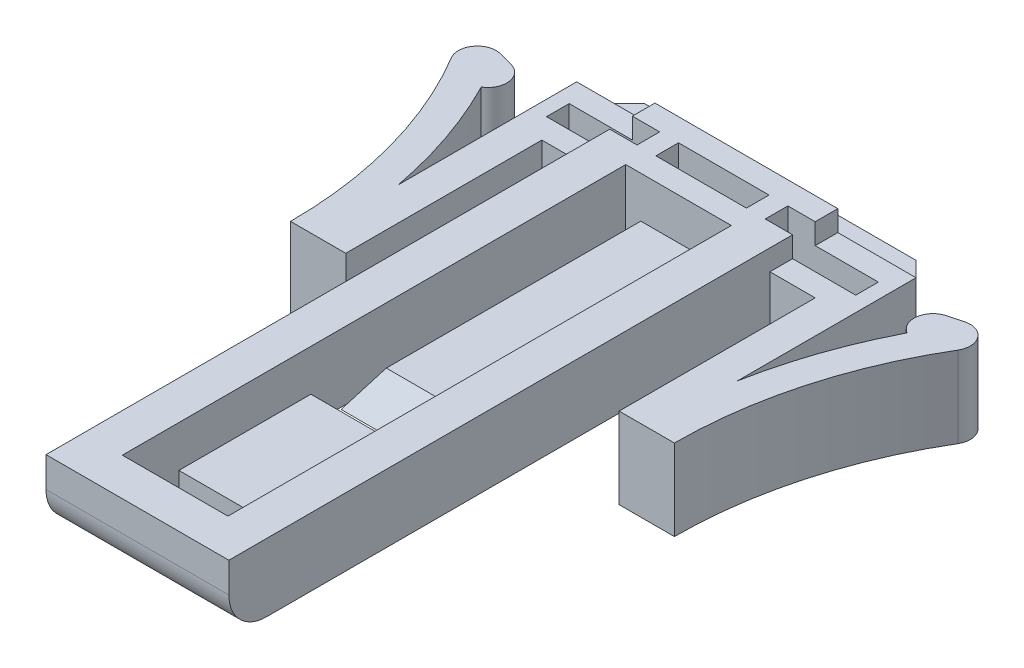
SolidWorks part; units mm, degrees
ref_plane "Спереди" through (0, 0, 0) normal (0, 0, 1) x (1, 0, 0)
ref_plane "Сверху" through (0, 0, 0) normal (0, 1, 0) x (1, 0, 0)
ref_plane "Справа" through (0, 0, 0) normal (1, 0, 0) x (0, 0, -1)
sketch "Эскиз1" plane through (0, 0, 0) normal (0, 1, 0) x (1, 0, 0)
  line L0 (0, 0) -> (0, 16.15) construction
  line L1 (4.85, 16.15) -> (-4.85, 16.15)
  line L2 (4.85, 16.15) -> (4.85, -16.15)
  line L3 (4.85, -16.15) -> (-4.85, -16.15)
  line L4 (-4.85, 16.15) -> (-4.85, -16.15)
  line L5 (4.85, 16.15) -> (-4.85, -16.15) construction
  line L6 (4.85, -16.15) -> (-4.85, 16.15) construction
  line L7 (-2.4, 14.95) -> (2.4, 14.95)
  line L8 (-2.4, 14.95) -> (-2.4, 13.75)
  line L9 (-2.4, 13.75) -> (2.4, 13.75)
  line L10 (2.4, 14.95) -> (2.4, 13.75)
  line L11 (4.85, 13.75) -> (3.4, 13.75)
  line L12 (4.85, 13.75) -> (4.85, 14.95)
  line L13 (4.85, 14.95) -> (3.4, 14.95)
  line L14 (3.4, 13.75) -> (3.4, 14.95)
  line L15 (-4.85, 13.75) -> (-3.4, 13.75)
  line L16 (-4.85, 13.75) -> (-4.85, 14.95)
  line L17 (-4.85, 14.95) -> (-3.4, 14.95)
  line L18 (-3.4, 13.75) -> (-3.4, 14.95)
  line L19 (-2, 12.55) -> (-2, -3.35)
  line L20 (-2.8, -14.15) -> (2.8, -14.15)
  line L21 (-2.8, -14.15) -> (-2.8, -11.15)
  line L22 (-2.8, -11.15) -> (2.8, -11.15)
  line L23 (2.8, -14.15) -> (2.8, -11.15)
  line L24 (2.8, -4.15) -> (-2.8, -4.15)
  line L25 (2.8, -4.15) -> (2.8, 12.55)
  line L26 (2.8, 12.55) -> (-2.8, 12.55)
  line L27 (-2.8, -4.15) -> (-2.8, 12.55)
  line L28 (-2, -3.35) -> (2, -3.35)
  line L29 (2, -3.35) -> (2, 12.55)
  point P0 (0, 0)
  dimension "D1" = 9.7
  dimension "D2" = 32.3
  dimension "D3" = 1.2
  dimension "D4" = 1.2
  dimension "D5" = 4.8
  dimension "D6" = 1
  dimension "D7" = 5.6
  dimension "D8" = 2
  dimension "D9" = 3
  dimension "D10" = 7
  dimension "D11" = 1.2
  dimension "D12" = 4
  dimension "D13" = 0.8
extrude "Бобышка-Вытянуть1" add sketch "Эскиз1" along normal blind 3.6 contours L18 L15 L4 L3 L2 L11 L14 L13 L1 L17 L23 L20 L21 L22 L7 L10 L9 L8 L24 L27 L26 L25 | L28 L29 L26 L19
fillet "Скругление1" radius 2 1 edges at (0, 0, 16.15)
sketch "Эскиз2" plane through (0, 0, 0) normal (0, -1, 0) x (1, 0, 0)
  line L0 (2, 3.35) -> (2, -12.55) construction
  line L1 (-2, 3.35) -> (2, 3.35)
  line L2 (-2, 3.35) -> (-2, -3.45)
  line L3 (-2, -3.45) -> (2, -3.45)
  line L4 (2, 3.35) -> (2, -3.45)
  dimension "D1" = 6.8
extrude "Бобышка-Вытянуть2" add sketch "Эскиз2" along normal blind 1.8
sketch "Эскиз3" plane through (0, 3.6, 0) normal (0, 1, 0) x (1, 0, 0)
  line L1 (2.8, -14.15) -> (-2.8, -14.15)
  line L2 (2.8, -14.15) -> (2.8, 12.55)
  line L3 (2.8, 12.55) -> (-2.8, 12.55)
  line L4 (-2.8, -14.15) -> (-2.8, 12.55)
extrude "Вырез-Вытянуть1" cut sketch "Эскиз3" against normal blind 2.2
sketch "Эскиз4" plane through (0, 0, 0) normal (1, 0, 0) x (0, 0, -1)
  line L0 (-3.35, 0.7) -> (-3.35, -1.8)
  line L1 (-3.35, 1.4) -> (-3.35, -1.8) construction
  line L2 (-3.35, -1.8) -> (0.65, -1.8)
  line L3 (-3.35, -1.8) -> (3.45, -1.8) construction
  line L4 (0.65, -1.8) -> (-3.35, 0.7)
  line L5 (-3.35, 1.4) -> (-0.95, 1.4)
  line L6 (12.55, 1.4) -> (-3.35, 1.4) construction
  line L7 (-0.95, 1.4) -> (-3.35, 0.7)
  line L8 (-3.35, 0.7) -> (-3.35, 1.4)
  line L9 (-4.15, 0.7) -> (-3.35, 0.7)
  line L10 (-4.15, 1.4) -> (-4.15, 0) construction
  line L11 (3.45, -1.8) -> (3.45, 0) construction
  point P14 (-3.35, 0.6668)
  point P18 (-3.35, 0.6714)
  dimension "D1" = 2.8
  dimension "D2" = 2.4
extrude "Вырез-Вытянуть2" cut sketch "Эскиз4" against normal mid plane 4.5 contours L2 L4 L0 | L8 L7 L5
ref_plane "Плоскость1" through (0, 2.5, 0) normal (0, 1, 0) x (1, 0, 0)
sketch "Эскиз5" plane through (0, 2.5, 0) normal (0, 1, 0) x (1, 0, 0)
  line L0 (-7.25, 12.55) -> (7.25, 12.55)
  line L1 (7.25, 12.55) -> (7.25, 2.15)
  line L2 (7.25, 2.15) -> (10.1812, 2.15)
  line L3 (-7.25, 12.55) -> (-7.25, 2.15)
  line L4 (-7.25, 2.15) -> (-10.1812, 2.15)
  line L5 (-9, 6.6697) -> (-9, 16.15)
  line L6 (-9, 16.15) -> (9, 16.15)
  line L7 (9, 16.15) -> (9, 6.6697)
  line L8 (0, 0) -> (0, 16.15) construction
  line L9 (4.85, 16.15) -> (-4.85, 16.15) construction
  line L10 (2.8, 12.55) -> (-2.8, 12.55) construction
  line L11 (4.85, 13.75) -> (3.4, 13.75) construction
  line L12 (-2.4, 14.95) -> (2.4, 14.95)
  line L13 (-2.4, 14.95) -> (-2.4, 13.75)
  line L14 (-2.4, 13.75) -> (2.4, 13.75)
  line L15 (2.4, 14.95) -> (2.4, 13.75)
  line L16 (3.4, 14.95) -> (8.2, 14.95)
  line L17 (3.4, 14.95) -> (3.4, 13.75)
  line L18 (3.4, 13.75) -> (8.2, 13.75)
  line L19 (8.2, 14.95) -> (8.2, 13.75)
  line L20 (-3.4, 14.95) -> (-8.2, 14.95)
  line L21 (-3.4, 14.95) -> (-3.4, 13.75)
  line L22 (-3.4, 13.75) -> (-8.2, 13.75)
  line L23 (-8.2, 14.95) -> (-8.2, 13.75)
  line L24 (-12.5727, 14.45) -> (-11.8, 14.2429) construction
  line L25 (-12.3139, 15.4159) -> (-11.5412, 15.2089)
  line L26 (-12.8316, 13.4841) -> (-12.0588, 13.277)
  line L27 (12.5727, 14.45) -> (11.8, 14.2429) construction
  line L28 (12.3139, 15.4159) -> (11.5412, 15.2089)
  line L29 (12.8316, 13.4841) -> (12.0588, 13.277)
  arc A0 (-12.3139, 15.4159) -> (-12.8316, 13.4841) centre (-12.5727, 14.45) ccw
  arc A1 (-12.0588, 13.277) -> (-11.5412, 15.2089) centre (-11.8, 14.2429) ccw
  arc A2 (-10.1812, 2.15) -> (-13.4314, 13.9375) centre (-33.1812, 2.15) ccw
  arc A3 (-9, 6.6697) -> (-11.2942, 13.3803) centre (-33.1812, 2.15) ccw
  arc A4 (12.3139, 15.4159) -> (12.8316, 13.4841) centre (12.5727, 14.45) cw
  arc A5 (12.0588, 13.277) -> (11.5412, 15.2089) centre (11.8, 14.2429) cw
  arc A6 (9, 6.6697) -> (11.2942, 13.3803) centre (33.1812, 2.15) cw
  arc A7 (10.1812, 2.15) -> (13.4314, 13.9375) centre (33.1812, 2.15) cw
  point P35 (-12.1864, 14.3465)
  point P44 (0, 0)
  point P46 (0, 0)
  point P47 (-12.7424, 12.335)
  point P48 (-9, 5.398)
  point P49 (-31.7295, 2.3883)
  point P50 (0, 0)
  point P51 (-33.8111, 2.15)
  point P52 (-33.3254, 2.15)
  point P55 (12.1864, 14.3465)
  point P64 (0, 0)
  dimension "D4" = 1
  dimension "D7" = 1.6
  dimension "D9" = 23
  dimension "D10" = 1.7
  dimension "D1" = 18
  dimension "D2" = 14.5
  dimension "D3" = 14
  dimension "D5" = 15
  dimension "D6" = 0.8
  dimension "D8" = 2.8
extrude "Бобышка-Вытянуть3" add sketch "Эскиз5" against normal blind 4.3 contours L2 A7 A4 L29 A5 A6 L7 L6 L5 A3 A1 L26 A0 A2 L4 L3 L0 L1 L16 L19 L18 L17 L12 L15 L14 L13 L23 L20 L21 L22 | A5 L29 A4 L28 | L26 A1 L25 A0
sketch "Эскиз6" plane through (0, 0, 0) normal (1, 0, 0) x (0, 0, -1)
  line L0 (16.15, -1.8) -> (17.95, 1.5)
  line L1 (17.95, 1.5) -> (16.15, 1.5)
  line L2 (16.15, -1.8) -> (16.15, 2.5) construction
  line L3 (16.15, 1.5) -> (16.15, -1.8)
  dimension "D1" = 3.3
  dimension "D2" = 1.8
extrude "Бобышка-Вытянуть4" add sketch "Эскиз6" along normal mid plane 18
sketch "Эскиз7" plane through (0, 1.5, 0) normal (0, 1, 0) x (1, 0, 0)
  line L0 (9, 16.15) -> (9, 17.95)
  line L1 (9, 17.95) -> (7.2, 17.95)
  line L2 (9, 17.95) -> (-9, 17.95) construction
  line L3 (7.2, 17.95) -> (9, 16.15)
  line L4 (-9, 17.95) -> (-9, 16.15)
  line L5 (-9, 16.15) -> (-7.2, 17.95)
  line L6 (-7.2, 17.95) -> (-9, 17.95)
  dimension "D1" = 45
  dimension "D2" = 45
extrude "Вырез-Вытянуть3" cut sketch "Эскиз7" against normal through all
